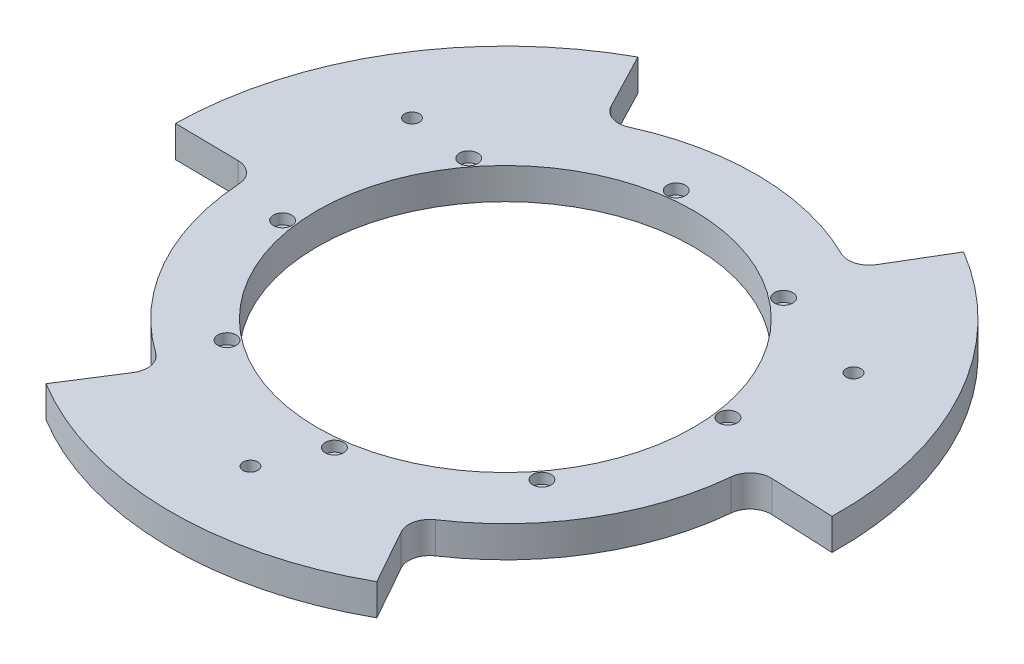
SolidWorks part; units mm, degrees
ref_plane "Front Plane" through (0, 0, 0) normal (0, 0, 1) x (1, 0, 0)
ref_plane "Top Plane" through (0, 0, 0) normal (0, 1, 0) x (1, 0, 0)
ref_plane "Right Plane" through (0, 0, 0) normal (1, 0, 0) x (0, 0, -1)
sketch "Sketch1" plane through (0, 0, 0) normal (0, 1, 0) x (1, 0, 0)
  circle A0 centre (0, 0) radius 101.6
  circle A1 centre (0, 0) radius 57.15
  dimension "D1" = 203.2
  dimension "D2" = 114.3
extrude "Boss-Extrude1" add sketch "Sketch1" along normal blind 9.525
sketch "Sketch6" plane through (0, 9.525, 0) normal (0, 1, 0) x (1, 0, 0)
  line L2 (0, 0) -> (134.0639, -2.0763) construction
  line L3 (49.6163, -88.661) -> (0, 0) construction
  line L4 (49.6163, -88.661) -> (40.1938, -71.8236)
  line L5 (101.5742, -2.2901) -> (82.4584, -1.454)
  line L6 (-101.5909, 1.3615) -> (-82.298, 1.1029)
  line L7 (-52.7704, -86.8208) -> (-42.4884, -70.6841)
  line L8 (51.9745, 87.2995) -> (42.1042, 70.7207)
  line L9 (-48.8038, 89.1109) -> (-39.97, 72.138)
  arc A1 (101.5742, -2.2901) -> (49.6163, -88.661) centre (0, 0) cw
  circle A2 centre (0, 0) radius 101.6 construction
  arc A3 (42.2171, -63.4363) -> (75.8593, -7.1981) centre (0, 0) ccw
  arc A6 (42.2171, -63.4363) -> (40.1938, -71.8236) centre (45.7351, -68.7226) ccw
  arc A7 (75.8593, -7.1981) -> (82.4584, -1.454) centre (82.1809, -7.7979) cw
  arc A8 (-52.7704, -86.8208) -> (-101.5909, 1.3615) centre (0, 0) cw
  arc A9 (-76.0459, -4.8429) -> (-44.1633, -62.097) centre (0, 0) ccw
  arc A10 (-76.0459, -4.8429) -> (-82.298, 1.1029) centre (-82.3831, -5.2465) ccw
  arc A11 (-44.1633, -62.097) -> (-42.4884, -70.6841) centre (-47.8436, -67.2718) cw
  arc A12 (-48.8038, 89.1109) -> (51.9745, 87.2995) centre (0, 0) cw
  arc A13 (33.8289, 68.2792) -> (-31.6959, 69.2951) centre (0, 0) ccw
  arc A14 (33.8289, 68.2792) -> (42.1042, 70.7207) centre (36.648, 73.9691) ccw
  arc A15 (-31.6959, 69.2951) -> (-39.97, 72.138) centre (-34.3373, 75.0697) cw
  point P12 (37.2123, -66.4958)
  point P32 (0, 0)
  dimension "D3" = 3
  dimension "D2" = 6.35
  dimension "D1" = 25.4
extrude "Cut-Extrude5" cut sketch "Sketch6" against normal through all
sketch "Sketch7" plane through (0, 9.525, 0) normal (0, 1, 0) x (1, 0, 0)
  line L0 (0, -106.2361) -> (0, 99.3374) construction
  line L1 (145.8627, 0) -> (-164.1494, 0) construction
  circle A0 centre (0, -77.47) radius 2.2479
  circle A1 centre (-67.091, 38.735) radius 2.2479
  circle A2 centre (67.091, 38.735) radius 2.2479
  point P13 (0, 0)
  dimension "D1" = 4.4958
  dimension "D2" = 77.47
  dimension "D3" = 3
extrude "Cut-Extrude6" cut sketch "Sketch7" against normal through all
sketch "Sketch8" plane through (0, 0, 0) normal (0, -1, 0) x (1, 0, 0)
  circle A0 centre (-59.8089, 7.874) radius 1.4732
  circle A1 centre (-36.7235, 47.859) radius 1.4732
  circle A2 centre (-47.859, -36.7235) radius 1.4732
  circle A3 centre (-7.874, -59.8089) radius 1.4732
  circle A4 centre (36.7235, -47.859) radius 1.4732
  circle A5 centre (59.8089, -7.874) radius 1.4732
  circle A6 centre (7.874, 59.8089) radius 1.4732
  circle A7 centre (47.859, 36.7235) radius 1.4732
  dimension "D1" = 2.9464
  dimension "D2" = 2.9464
  dimension "D3" = 2.9464
  dimension "D4" = 2.9464
  dimension "D5" = 2.9464
  dimension "D6" = 2.9464
  dimension "D7" = 2.9464
  dimension "D8" = 2.9464
extrude "Cut-Extrude7" cut sketch "Sketch8" against normal through all
sketch "Sketch9" plane through (0, 9.525, 0) normal (0, 1, 0) x (1, 0, 0)
  circle A0 centre (-36.7235, -47.859) radius 2.7781
  circle A1 centre (-59.8089, -7.874) radius 2.7781
  circle A2 centre (-47.859, 36.7235) radius 2.7781
  circle A3 centre (-7.874, 59.8089) radius 2.7781
  circle A4 centre (36.7235, 47.859) radius 2.7781
  circle A5 centre (59.8089, 7.874) radius 2.7781
  circle A6 centre (47.859, -36.7235) radius 2.7781
  circle A7 centre (7.874, -59.8089) radius 2.7781
  dimension "D1" = 5.5562
  dimension "D2" = 5.5562
  dimension "D3" = 5.5562
  dimension "D4" = 5.5562
  dimension "D5" = 5.5562
  dimension "D6" = 5.5562
  dimension "D7" = 5.5562
  dimension "D8" = 5.5562
extrude "Cut-Extrude8" cut sketch "Sketch9" against normal blind 3.175
